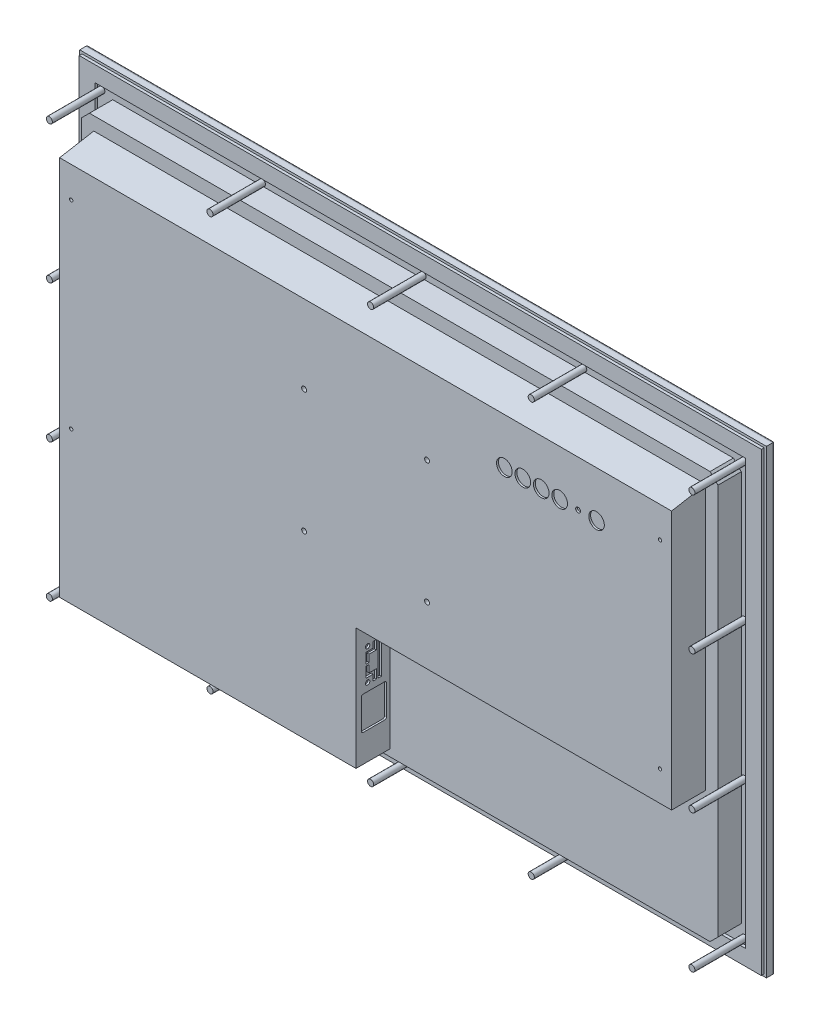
SolidWorks part; units mm, degrees
ref_plane "Front Plane" through (0, 0, 0) normal (0, 0, 1) x (1, 0, 0)
ref_plane "Top Plane" through (0, 0, 0) normal (0, 1, 0) x (1, 0, 0)
ref_plane "Right Plane" through (0, 0, 0) normal (1, 0, 0) x (0, 0, -1)
sketch "Sketch1" plane through (0, 0, 0) normal (0, 0, 1) x (1, 0, 0)
  line L0 (-279.4, 187.325) -> (279.4, 187.325)
  line L1 (279.4, 187.325) -> (279.4, -187.325)
  line L2 (279.4, -187.325) -> (-279.4, -187.325)
  line L3 (-279.4, -187.325) -> (-279.4, 187.325)
  point P2 (0, -187.325)
  point P3 (279.4, 0)
  dimension "D1" = 558.8
  dimension "D2" = 374.65
extrude "Bezel" add sketch "Sketch1" against normal blind 7.112
fillet "Bezel Radius" radius 2 4 edges at (0, -187.325, -7.112) (0, 187.325, -7.112) (-279.4, 0, -7.112) (279.4, 0, -7.112)
sketch "Sketch2" plane through (0, 0, -7.112) normal (0, 0, -1) x (-1, 0, 0)
  line L0 (-237.236, 148.336) -> (237.236, 148.336)
  line L1 (237.236, 148.336) -> (237.236, -148.336)
  line L2 (237.236, -148.336) -> (-237.236, -148.336)
  line L3 (-237.236, -148.336) -> (-237.236, 148.336)
  line L4 (277.4, 185.325) -> (-277.4, 185.325) construction
  line L5 (-277.4, 185.325) -> (-277.4, -185.325) construction
  point P0 (0, 148.336)
  point P6 (0, 185.325)
  point P8 (-237.236, 0)
  point P11 (-277.4, 0)
  dimension "D1" = 474.472
  dimension "D2" = 296.672
extrude "Window" cut sketch "Sketch2" against normal blind 2.35
sketch "Sketch3" plane through (0, 0, 0) normal (0, 0, 1) x (1, 0, 0)
  line L4 (-277.495, 185.42) -> (277.495, 185.42)
  line L5 (277.495, 185.42) -> (277.495, -185.42)
  line L6 (277.495, -185.42) -> (-277.495, -185.42)
  line L7 (-277.495, -185.42) -> (-277.495, 185.42)
  line L8 (279.4, 187.325) -> (-279.4, 187.325) construction
  line L9 (-279.4, 187.325) -> (-279.4, -187.325) construction
  line L10 (-279.4, -187.325) -> (279.4, -187.325) construction
  line L11 (279.4, -187.325) -> (279.4, 187.325) construction
  line L12 (-264.795, -172.72) -> (-264.795, 172.72)
  line L13 (-264.795, 172.72) -> (264.795, 172.72)
  line L14 (264.795, 172.72) -> (264.795, -172.72)
  line L15 (264.795, -172.72) -> (-264.795, -172.72)
  dimension "D1" = 1.905
  dimension "D2" = 1.905
  dimension "D3" = 1.905
  dimension "D4" = 1.905
  dimension "D5" = 12.7
extrude "Gasket" add sketch "Sketch3" along normal blind 2.3
sketch "Sketch5" plane through (0, 0, 0) normal (0, 0, 1) x (1, 0, 0)
  line L0 (-279.4, 187.325) -> (-279.4, -187.325) construction
  line L1 (279.4, 187.325) -> (-279.4, 187.325) construction
  circle A0 centre (-261.4168, 168.1226) radius 2.5
  circle A22 centre (-130.7084, 168.1226) radius 2.5
  circle A23 centre (-130.7084, -168.148) radius 2.5
  circle A24 centre (0, 168.1226) radius 2.5
  circle A25 centre (0, -168.148) radius 2.5
  circle A26 centre (130.7084, 168.1226) radius 2.5
  circle A27 centre (130.7084, -168.148) radius 2.5
  circle A28 centre (261.4168, 168.1226) radius 2.5
  circle A29 centre (261.4168, -168.148) radius 2.5
  circle A31 centre (-261.4168, -56.0578) radius 2.5
  circle A32 centre (-261.4168, -168.148) radius 2.5
  circle A33 centre (-261.4168, 56.0324) radius 2.5
  circle A34 centre (-261.4168, 56.0324) radius 2.5
  circle A35 centre (261.4168, 56.0324) radius 2.5
  circle A36 centre (-261.4168, -56.0578) radius 2.5
  circle A37 centre (261.4168, -56.0578) radius 2.5
  dimension "D1" = 5
  dimension "D2" = 17.9832
  dimension "D3" = 19.2024
  dimension "D4" = 3
  dimension "D5" = 130.7084
  dimension "D6" = 5
  dimension "D7" = 4
  dimension "D8" = 112.0902
extrude "Panel Frame Studs" add sketch "Sketch5" along normal blind 42.7
sketch "Sketch6" plane through (0, 0, 0) normal (0, 0, 1) x (1, 0, 0)
  line L0 (-258.9168, 159.2107) -> (-252.5049, 165.6226)
  line L1 (-252.5049, 165.6226) -> (252.5049, 165.6226)
  line L2 (252.5049, 165.6226) -> (258.9168, 159.2107)
  line L3 (258.9168, 159.2107) -> (258.9168, -159.2361)
  line L4 (258.9168, -159.2361) -> (252.5049, -165.648)
  line L5 (252.5049, -165.648) -> (-252.5049, -165.648)
  line L6 (-252.5049, -165.648) -> (-258.9168, -159.2361)
  line L7 (-258.9168, -159.2361) -> (-258.9168, 159.2107)
  circle A0 centre (-261.4168, 168.1226) radius 2.5 construction
  circle A6 centre (261.4168, 56.0324) radius 2.5 construction
  circle A7 centre (-130.7084, -168.148) radius 2.5 construction
  dimension "D1" = 9.0678
  dimension "D2" = 45
extrude "Body" add sketch "Sketch6" along normal blind 18.9738 separate body
sketch "Sketch7" plane through (0, 0, 18.9738) normal (0, 0, 1) x (1, 0, 0)
  line L0 (-248.9708, 154.813) -> (248.9708, 154.813)
  line L1 (248.9708, 154.813) -> (248.9708, -60.833)
  line L2 (248.9708, -60.833) -> (-7.8232, -60.833)
  line L3 (-7.8232, -60.833) -> (-7.8232, -159.893)
  line L4 (-7.8232, -159.893) -> (-248.9708, -159.893)
  line L5 (-248.9708, -159.893) -> (-248.9708, 154.813)
  line L6 (-252.5049, -165.648) -> (252.5049, -165.648) construction
  line L7 (-279.4, -187.325) -> (279.4, -187.325) construction
  line L9 (-258.9168, 159.2107) -> (-258.9168, -159.2361) construction
  point P3 (0, 154.813)
  dimension "D1" = 497.9416
  dimension "D2" = 215.646
  dimension "D3" = 256.794
  dimension "D4" = 99.06
  dimension "D5" = 27.432
extrude "Rear Cover" add sketch "Sketch7" along normal blind 27.7876
draft "Rear Cover Slope" type of draft neutral plane draft angle 10 faces to draft 1 parameters "D1"=10
sketch "Sketch10" plane through (0, -60.833, 0) normal (0, 1, 0) x (1, 0, 0)
  line L4 (248.9708, -46.7614) -> (248.9708, -18.9738) construction
  line L5 (-7.8232, -18.9738) -> (248.9708, -18.9738) construction
  line L53 (120.7401, -42.3233) -> (120.7401, -37.2433)
  line L54 (96.4641, -45.4958) -> (117.6921, -45.4958)
  line L55 (96.4641, -34.0709) -> (117.6921, -34.0709)
  line L56 (93.4161, -37.2433) -> (93.4161, -42.3233)
  line L57 (154.8831, -38.5006) -> (154.8831, -43.5806)
  line L58 (137.6111, -46.7531) -> (151.8351, -46.7531)
  line L59 (134.5631, -38.5006) -> (134.5631, -43.5806)
  line L60 (137.6111, -35.3282) -> (151.7075, -35.3256)
  line L61 (178.6229, -34.2842) -> (178.6229, -39.3642)
  line L62 (195.8949, -31.1118) -> (181.6709, -31.1118)
  line L63 (198.9429, -39.3642) -> (198.9429, -34.2842)
  line L64 (181.6709, -42.5367) -> (195.7673, -42.5392)
  line L65 (232.3903, -30.7155) -> (216.3883, -30.7155)
  line L66 (232.3903, -38.399) -> (232.3903, -42.9075)
  line L67 (216.3883, -42.9075) -> (232.3903, -42.9075)
  line L68 (216.3883, -38.399) -> (216.3883, -42.9075)
  line L69 (211.9433, -38.399) -> (216.3883, -38.399)
  line L70 (211.9433, -35.224) -> (216.3883, -35.224)
  line L71 (216.3883, -30.7155) -> (216.3883, -35.224)
  line L72 (232.3903, -35.224) -> (232.3903, -30.7155)
  line L73 (232.3903, -38.399) -> (236.8353, -38.399)
  line L74 (232.3903, -35.224) -> (236.8353, -35.224)
  circle A42 centre (123.3341, -39.7833) radius 1.5875
  arc A43 (120.7401, -42.3233) -> (117.6921, -45.4958) centre (117.5651, -42.3233) cw
  arc A44 (117.6921, -34.0709) -> (120.7401, -37.2433) centre (117.5651, -37.2433) cw
  arc A45 (93.4161, -37.2433) -> (96.4641, -34.0709) centre (96.5911, -37.2433) cw
  arc A46 (96.4641, -45.4958) -> (93.4161, -42.3233) centre (96.5911, -42.3233) cw
  circle A47 centre (90.8221, -39.7833) radius 1.5875
  arc A48 (137.6111, -46.7531) -> (134.5631, -43.5806) centre (137.7381, -43.5806) cw
  circle A49 centre (157.2231, -41.0533) radius 1.5875
  arc A50 (154.8831, -43.5806) -> (151.8351, -46.7531) centre (151.7081, -43.5806) cw
  circle A51 centre (132.2231, -41.0533) radius 1.5875
  arc A52 (134.5631, -38.5006) -> (137.6111, -35.3282) centre (137.7381, -38.5006) cw
  arc A53 (151.7075, -35.3256) -> (154.8831, -38.5006) centre (151.7081, -38.5006) cw
  circle A54 centre (176.2829, -36.8115) radius 1.5875
  arc A55 (178.6229, -34.2842) -> (181.6709, -31.1118) centre (181.7979, -34.2842) cw
  arc A56 (195.8949, -31.1118) -> (198.9429, -34.2842) centre (195.7679, -34.2842) cw
  arc A57 (198.9429, -39.3642) -> (195.7673, -42.5392) centre (195.7679, -39.3642) cw
  arc A58 (181.6709, -42.5367) -> (178.6229, -39.3642) centre (181.7979, -39.3642) cw
  circle A59 centre (201.2829, -36.8115) radius 1.5875
  arc A60 (211.9433, -38.399) -> (211.9433, -35.224) centre (211.9433, -36.8115) cw
  arc A61 (236.8353, -35.224) -> (236.8353, -38.399) centre (236.8353, -36.8115) cw
  dimension "D1" = 3.175
  dimension "D2" = 3.175
  dimension "D4" = 12.1355
  dimension "D5" = 16.5805
  dimension "D6" = 32.5825
  dimension "D7" = 47.6879
  dimension "D8" = 50.0279
  dimension "D9" = 53.0759
  dimension "D10" = 53.2035
  dimension "D11" = 94.0877
  dimension "D12" = 128.2307
  dimension "D13" = 131.2787
  dimension "D14" = 152.3797
  dimension "D15" = 72.6879
  dimension "D16" = 91.7477
  dimension "D17" = 11.7417
  dimension "D18" = 12.138
  dimension "D19" = 15.0971
  dimension "D20" = 16.3518
  dimension "D21" = 20.3904
  dimension "D22" = 23.9337
  dimension "D24" = 116.7477
  dimension "D25" = 125.6367
  dimension "D29" = 20.8095
  dimension "D30" = 22.0795
  dimension "D32" = 158.1487
extrude "Video / Touch Interface" cut sketch "Sketch10" along normal blind 1.524 from surface at 0
sketch "Sketch11" plane through (-7.8232, 0, 0) normal (-1, 0, 0) x (0, 0, 1)
  line L2 (32.7914, -105.2237) -> (32.7914, -100.4104)
  line L3 (32.7914, -105.2237) -> (30.2514, -105.2237)
  line L8 (30.2514, -105.2237) -> (30.2514, -97.8704)
  line L9 (28.7274, -77.2837) -> (28.7274, -105.2237)
  line L10 (28.7274, -105.2237) -> (26.1874, -105.2237)
  line L11 (26.1874, -105.2237) -> (26.1874, -77.2837)
  line L12 (26.1874, -77.2837) -> (28.7274, -77.2837)
  line L13 (30.2514, -77.2837) -> (32.7914, -77.2837)
  line L14 (32.7914, -77.2837) -> (32.7914, -82.097)
  line L15 (30.2514, -77.2837) -> (30.2514, -84.637)
  line L16 (30.2514, -84.637) -> (36.1442, -84.637)
  line L17 (32.7914, -82.097) -> (38.6842, -82.097)
  line L18 (38.6842, -82.097) -> (38.6842, -90.4917)
  line L19 (38.6842, -90.4917) -> (36.1442, -90.4917)
  line L20 (36.1442, -84.637) -> (36.1442, -90.4917)
  line L21 (36.1442, -92.0157) -> (38.6842, -92.0157)
  line L22 (38.6842, -100.4104) -> (38.6842, -92.0157)
  line L23 (36.1442, -92.0157) -> (36.1442, -97.8704)
  line L24 (30.2514, -97.8704) -> (36.1442, -97.8704)
  line L25 (32.7914, -100.4104) -> (38.6842, -100.4104)
  line L69 (21.9331, -111.9559) -> (21.9331, -135.8954)
  line L70 (23.4571, -110.4319) -> (40.907, -110.4319)
  line L71 (42.431, -135.8954) -> (42.431, -111.9559)
  line L72 (40.907, -137.4194) -> (23.4571, -137.4194)
  line L74 (18.9738, -159.893) -> (18.9738, -60.833) construction
  line L75 (46.7614, -60.833) -> (18.9738, -60.833) construction
  circle A0 centre (37.2872, -104.0426) radius 1.7907
  circle A1 centre (37.2872, -78.4648) radius 1.7907
  arc A14 (23.4571, -137.4194) -> (21.9331, -135.8954) centre (23.4571, -135.8954) cw
  arc A15 (21.9331, -111.9559) -> (23.4571, -110.4319) centre (23.4571, -111.9559) cw
  arc A16 (40.907, -110.4319) -> (42.431, -111.9559) centre (40.907, -111.9559) cw
  arc A17 (42.431, -135.8954) -> (40.907, -137.4194) centre (40.907, -135.8954) cw
  dimension "D1" = 3.5814
  dimension "D2" = 1.524
  dimension "D3" = 2.9593
  dimension "D4" = 11.2776
  dimension "D5" = 13.8176
  dimension "D6" = 17.1704
  dimension "D7" = 16.4507
  dimension "D8" = 17.6318
  dimension "D9" = 18.3134
  dimension "D10" = 21.264
  dimension "D11" = 23.4572
  dimension "D12" = 23.804
  dimension "D13" = 29.6587
  dimension "D14" = 43.2096
  dimension "D15" = 44.3907
  dimension "D16" = 49.5989
  dimension "D17" = 76.5864
  dimension "D18" = 7.2136
extrude "Power AC and DC" cut sketch "Sketch11" along normal blind 1.524 from surface at 0
sketch "Sketch12" plane through (0, 0, 46.7614) normal (0, 0, 1) x (1, 0, 0)
  line L0 (-248.9708, 149.9133) -> (-248.9708, -159.893) construction
  line L1 (-248.9708, -159.893) -> (-7.8232, -159.893) construction
  circle A6 centre (112.913, 112.6009) radius 6.35
  circle A7 centre (127.913, 112.6009) radius 6.35
  circle A8 centre (142.913, 112.6009) radius 6.35
  circle A9 centre (157.913, 112.6009) radius 6.35
  circle A10 centre (172.913, 112.6009) radius 1.9812
  circle A11 centre (187.913, 112.6009) radius 6.35
  dimension "D8" = 436.8838
  dimension "D9" = 272.4939
  dimension "D4" = 376.8838
  dimension "D6" = 406.8838
  dimension "D7" = 421.8838
  dimension "D1" = 12.7
  dimension "D2" = 3.9624
  dimension "D3" = 361.8838
  dimension "D5" = 391.8838
extrude "Controls Buttons" cut sketch "Sketch12" against normal blind 1.524 from surface at 0
hole_wizard "6-32 Accessory Bracket Holes" positions "Sketch13" profile "Sketch14" hole size "#6-32" standard "ANSI Inch"
sketch "Sketch13" plane through (0, 0, 46.7614) normal (0, 0, 1) x (1, 0, 0)
  line L2 (-248.9708, -159.893) -> (-7.8232, -159.893) construction
  line L3 (-239.522, 124.8918) -> (239.522, 124.8918) construction
  line L5 (248.9708, 149.9133) -> (-248.9708, 149.9133) construction
  point P0 (-239.522, -36.449)
  point P2 (-239.522, 124.8918)
  point P4 (239.522, 124.8918)
  point P6 (239.522, -36.449)
  point P27 (0, 124.8918)
  point P28 (0, 149.9133)
  dimension "D1" = 161.3408
  dimension "D2" = 479.044
  dimension "D4" = 123.444
sketch "Sketch14" plane through (-239.522, -36.449, 46.7614) normal (1, 0, 0) x (0, -1, 0)
  line L0 (0, 0) -> (0, 16.8147)
  line L1 (0, 16.8147) -> (1.3525, 16.002)
  line L2 (1.3525, 16.002) -> (1.3525, 0)
  line L5 (1.3525, 0) -> (0, 0)
  line L10 (0, 16.8147) -> (-1.3526, 16.002) construction
  line L11 (0, -6.35) -> (0, 107.95) construction
  dimension "Hole Dia." = 2.7051
  dimension "Hole Depth" = 16.002
  dimension "Drill Angle" = 118
hole_wizard "Ø4.0mm Dowel Hole1" positions "Sketch15" profile "Sketch16" hole size "Ø4.0" standard "ANSI Metric"
sketch "Sketch15" plane through (0, 0, 46.7614) normal (0, 0, 1) x (1, 0, 0)
  line L0 (-7.8232, -60.833) -> (248.9708, -60.833) construction
  line L1 (-50, 86.322) -> (50, 86.322) construction
  line L3 (248.9708, 149.9133) -> (-248.9708, 149.9133) construction
  circle A0 centre (112.913, 112.6009) radius 6.35 construction
  point P3 (-50, 86.322)
  point P4 (50, 86.322)
  point P5 (50, -13.678)
  point P6 (-50, -13.678)
  point P22 (0, 149.9133)
  point P23 (0, 86.322)
  dimension "D1" = 47.155
  dimension "D2" = 100
  dimension "D3" = 100
sketch "Sketch16" plane through (-50, 86.322, 46.7614) normal (1, 0, 0) x (0, -1, 0)
  line L0 (0, 0) -> (0, 17.2037)
  line L1 (0, 17.2037) -> (2, 16.002)
  line L2 (2, 16.002) -> (2, 0)
  line L5 (2, 0) -> (0, 0)
  line L10 (0, 17.2037) -> (-2, 16.002) construction
  line L11 (0, -6.35) -> (0, 107.95) construction
  dimension "Hole Dia." = 4
  dimension "Hole Depth" = 16.002
  dimension "Drill Angle" = 118
